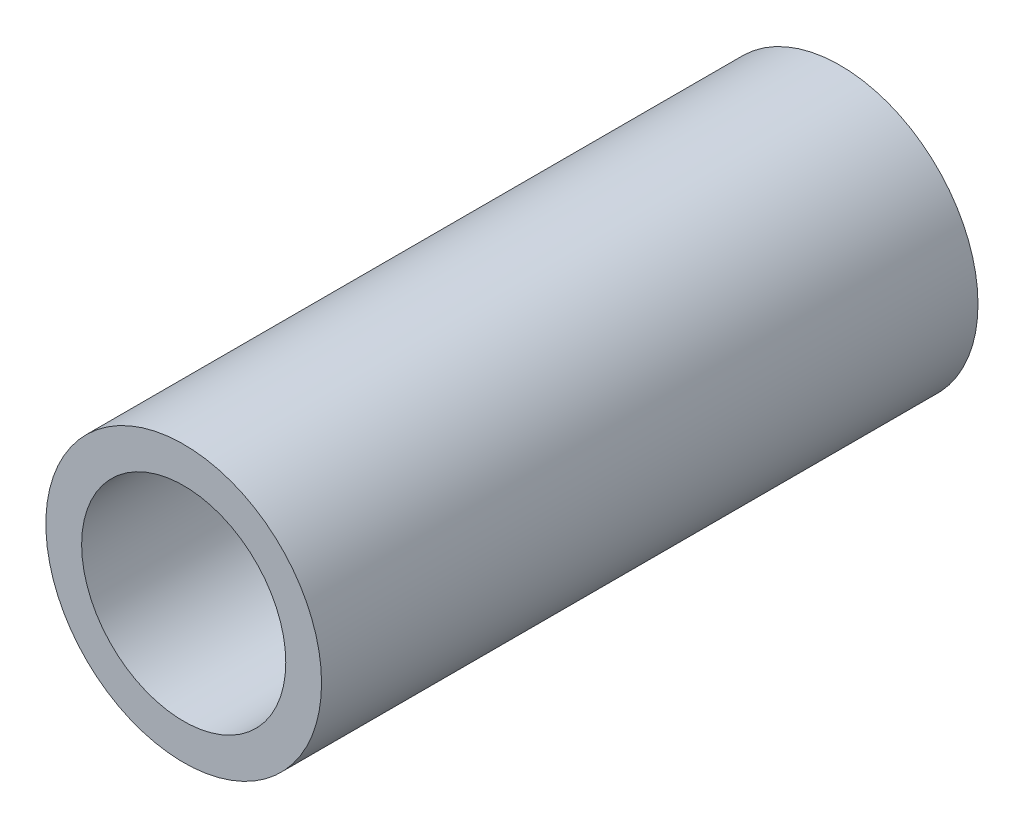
SolidWorks part; units mm, degrees
ref_plane "Front" through (0, 0, 0) normal (0, 0, 1) x (1, 0, 0)
ref_plane "Top" through (0, 0, 0) normal (0, 1, 0) x (1, 0, 0)
ref_plane "Side" through (0, 0, 0) normal (1, 0, 0) x (0, 0, -1)
sketch "PipeSketch"
  dimension "OuterDiameter" = 21.336
  dimension "InnerDiameter" = 15.7988
extrude "Extrusion" add sketch "PipeSketch" along normal blind 50.8
sketch "FilterSketch" plane through (0, 0, 0) normal (0, 0, 1) x (1, 0, 0)
  circle A0 centre (0, 0) radius 6.35 construction
  dimension "NominalDiameter" = 12.7
